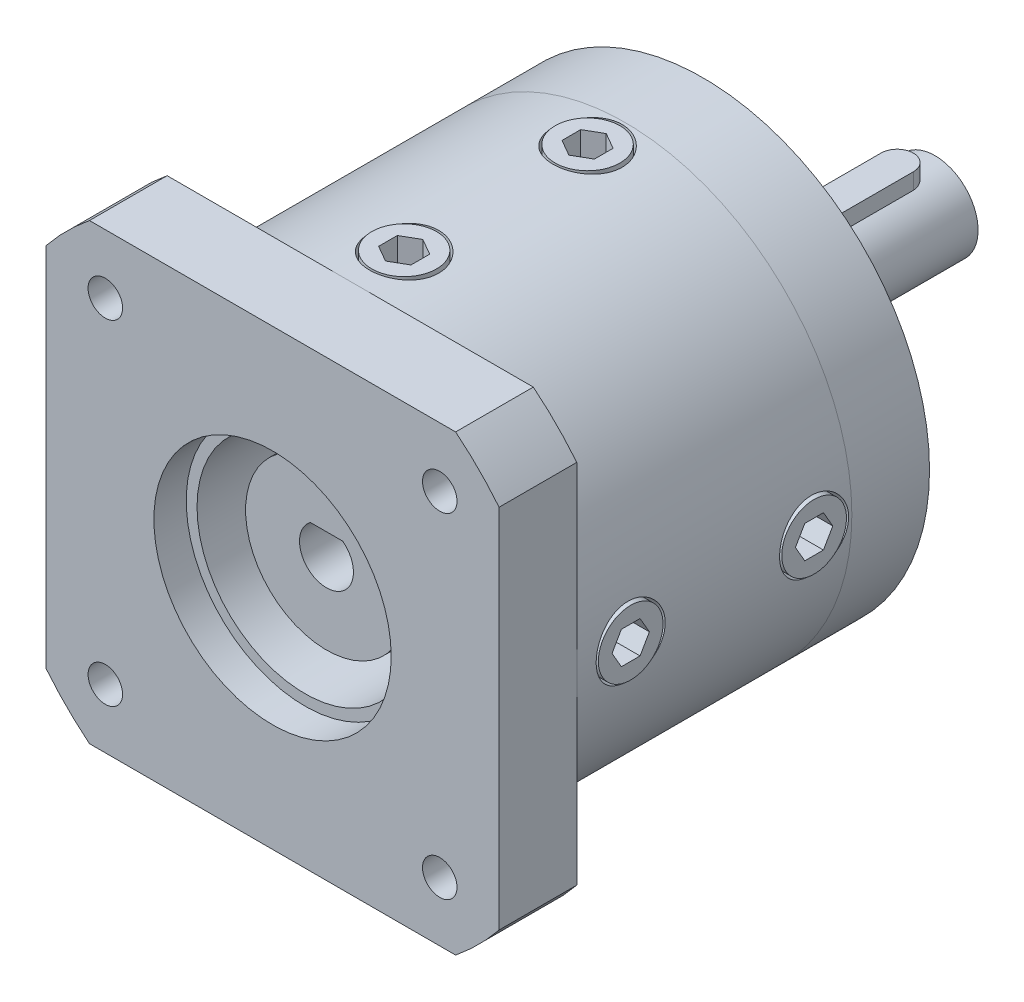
SolidWorks part; units mm, degrees
ref_plane "前视基准面" through (0, 0, 0) normal (0, 0, 1) x (1, 0, 0)
ref_plane "上视基准面" through (0, 0, 0) normal (0, 1, 0) x (1, 0, 0)
ref_plane "右视基准面" through (0, 0, 0) normal (1, 0, 0) x (0, 0, -1)
sketch "草图1" plane through (0, 0, 0) normal (0, 0, 1) x (1, 0, 0)
  line L1 (-16.9706, -21) -> (16.9706, -21)
  line L2 (-21, -16.9706) -> (-21, 16.9706)
  line L3 (-16.9706, 21) -> (16.9706, 21)
  line L4 (21, -16.9706) -> (21, 16.9706)
  line L5 (0, 21) -> (0, -21) construction
  line L6 (-21, 0) -> (21, 0) construction
  line L7 (-15.5, -15.5) -> (15.5, -15.5) construction
  line L8 (-15.5, -15.5) -> (-15.5, 15.5) construction
  line L9 (-15.5, 15.5) -> (15.5, 15.5) construction
  line L10 (15.5, -15.5) -> (15.5, 15.5) construction
  line L11 (0, 15.5) -> (0, -15.5) construction
  line L12 (-15.5, 0) -> (15.5, 0) construction
  arc A0 (-21, -16.9706) -> (-16.9706, -21) centre (0, 0) ccw
  arc A1 (16.9706, -21) -> (21, -16.9706) centre (0, 0) ccw
  arc A2 (21, 16.9706) -> (16.9706, 21) centre (0, 0) ccw
  arc A3 (-16.9706, 21) -> (-21, 16.9706) centre (0, 0) ccw
  circle A4 centre (-15.5, 15.5) radius 1.6
  circle A5 centre (15.5, 15.5) radius 1.6
  circle A6 centre (15.5, -15.5) radius 1.6
  circle A7 centre (-15.5, -15.5) radius 1.6
  point P0 (0, 0)
  point P22 (0, 0)
  dimension "D3" = 54
  dimension "D5" = 3.2
  dimension "D1" = 42
  dimension "D2" = 31
  dimension "D4" = 31
  dimension "D6" = 4
extrude "凸台-拉伸1" add sketch "草图1" along normal blind 7.2
sketch "草图2" plane through (0, 0, 0) normal (0, 0, -1) x (-1, 0, 0)
  circle A0 centre (0, 0) radius 21
  dimension "D1" = 42
extrude "凸台-拉伸2" add sketch "草图2" along normal blind 1.5
sketch "草图3" plane through (0, 0, -1.5) normal (0, 0, -1) x (-1, 0, 0)
  circle A0 centre (0, 0) radius 21
  dimension "D1" = 42
extrude "凸台-拉伸3" add sketch "草图3" along normal blind 24 separate body
sketch "草图4" plane through (0, 0, -25.5) normal (0, 0, -1) x (-1, 0, 0)
  circle A0 centre (0, 0) radius 21
  dimension "D1" = 42
extrude "凸台-拉伸4" add sketch "草图4" along normal blind 7.2 separate body
sketch "草图5" plane through (0, 0, -32.7) normal (0, 0, -1) x (-1, 0, 0)
  circle A0 centre (0, 0) radius 12.5
  circle A1 centre (0, 0) radius 11
  dimension "D1" = 25
  dimension "D2" = 22
extrude "凸台-拉伸5" add sketch "草图5" along normal blind 2
sketch "草图6" plane through (0, 0, 7.2) normal (0, 0, 1) x (1, 0, 0)
  circle A0 centre (0, 0) radius 11
  dimension "D1" = 22
extrude "切除-拉伸1" cut sketch "草图6" against normal blind 3
sketch "草图9" plane through (0, 0, -1.5) normal (0, 0, -1) x (-1, 0, 0)
  circle A0 centre (-15.5, 15.5) radius 3
  circle A1 centre (15.5, 15.5) radius 3
  circle A2 centre (15.5, -15.5) radius 3
  circle A3 centre (-15.5, -15.5) radius 3
  point P11 (0, 0)
  dimension "D1" = 6
  dimension "D2" = 4
extrude "切除-拉伸4" cut sketch "草图9" against normal blind 5
hole_wizard "M4 螺纹孔1" positions "草图11" profile "草图12" tap size "M4" standard "GB"
sketch "草图11" plane through (0, 0, -32.7) normal (0, 0, -1) x (-1, 0, 0)
  line L0 (-39.831, 0) -> (39.831, 0) construction
  line L2 (0, -29.9711) -> (0, 29.9711) construction
  circle A1 centre (0, 0) radius 17.5 construction
  point P0 (0, 17.5)
  point P2 (17.5, 0)
  point P4 (-17.5, 0)
  point P6 (0, -17.5)
  point P57 (0, 0)
  point P92 (0, 0)
  dimension "D1" = 35
sketch "草图12" plane through (0, 17.5, -32.7) normal (1, 0, 0) x (0, 1, 0)
  line L0 (0, 0) -> (0, 6.9914)
  line L1 (0, 6.9914) -> (1.65, 6)
  line L2 (1.65, 6) -> (1.65, 0)
  line L5 (1.65, 0) -> (0, 0)
  line L10 (0, 6.9914) -> (-1.65, 6) construction
  line L11 (0, -6.35) -> (0, 107.95) construction
  dimension "螺纹孔钻头直径" = 3.3
  dimension "螺纹孔钻头深度" = 6
  dimension "导头角度" = 118
sketch "草图13" plane through (-21, 0, 0) normal (-1, 0, 0) x (0, 0, 1)
  line L0 (0, 0) -> (-40.8495, 0) construction
  line L1 (-25.5, 0) -> (-22, 0) construction
  line L2 (-25.5, -21) -> (-25.5, 21) construction
  line L3 (-1.5, 0) -> (-5, 0) construction
  line L4 (-1.5, 12.7459) -> (-1.5, -12.7459) construction
  circle A0 centre (-22, 0) radius 3.2
  circle A1 centre (-5, 0) radius 3.2
  dimension "D3" = 6.4
  dimension "D4" = 6.4
  dimension "D1" = 3.5
  dimension "D2" = 3.5
extrude "切除-拉伸5" cut sketch "草图13" against normal blind 5
sketch "草图14" plane through (-16, 0, 0) normal (-1, 0, 0) x (0, 0, 1)
  line L1 (-20.2679, 0) -> (-21.134, 1.5)
  line L2 (-21.134, 1.5) -> (-22.866, 1.5)
  line L3 (-22.866, 1.5) -> (-23.7321, 0)
  line L4 (-23.7321, 0) -> (-22.866, -1.5)
  line L5 (-22.866, -1.5) -> (-21.134, -1.5)
  line L6 (-21.134, -1.5) -> (-20.2679, 0)
  line L7 (-3.2679, 0) -> (-4.134, 1.5)
  line L8 (-4.134, 1.5) -> (-5.866, 1.5)
  line L9 (-5.866, 1.5) -> (-6.7321, 0)
  line L10 (-6.7321, 0) -> (-5.866, -1.5)
  line L11 (-5.866, -1.5) -> (-4.134, -1.5)
  line L12 (-4.134, -1.5) -> (-3.2679, 0)
  circle A0 centre (-22, 0) radius 3
  circle A1 centre (-5, 0) radius 3
  circle A2 centre (-22, 0) radius 1.5 construction
  circle A3 centre (-5, 0) radius 1.5 construction
  dimension "D1" = 6
  dimension "D2" = 6
  dimension "D3" = 3
  dimension "D4" = 3
extrude "凸台-拉伸6" add sketch "草图14" along normal blind 5
sketch "草图15" plane through (0, 21, 0) normal (0, 1, 0) x (1, 0, 0)
  line L0 (0, 0) -> (0, 43.4375) construction
  line L1 (0, 25.5) -> (0, 22) construction
  line L2 (-21, 25.5) -> (21, 25.5) construction
  line L3 (0, 1.5) -> (0, 5) construction
  line L4 (-21, 1.5) -> (21, 1.5) construction
  circle A0 centre (0, 22) radius 3.2
  circle A1 centre (0, 5) radius 3.2
  dimension "D3" = 6.4
  dimension "D4" = 6.4
  dimension "D1" = 3.5
  dimension "D2" = 3.5
extrude "切除-拉伸7" cut sketch "草图15" against normal blind 5
sketch "草图16" plane through (0, 16, 0) normal (0, 1, 0) x (1, 0, 0)
  line L1 (0, 20.2679) -> (1.5, 21.134)
  line L2 (1.5, 21.134) -> (1.5, 22.866)
  line L3 (1.5, 22.866) -> (0, 23.7321)
  line L4 (0, 23.7321) -> (-1.5, 22.866)
  line L5 (-1.5, 22.866) -> (-1.5, 21.134)
  line L6 (-1.5, 21.134) -> (0, 20.2679)
  line L7 (0, 3.2679) -> (1.5, 4.134)
  line L8 (1.5, 4.134) -> (1.5, 5.866)
  line L9 (1.5, 5.866) -> (0, 6.7321)
  line L10 (0, 6.7321) -> (-1.5, 5.866)
  line L11 (-1.5, 5.866) -> (-1.5, 4.134)
  line L12 (-1.5, 4.134) -> (0, 3.2679)
  circle A0 centre (0, 22) radius 3
  circle A1 centre (0, 5) radius 3
  circle A2 centre (0, 22) radius 1.5 construction
  circle A3 centre (0, 5) radius 1.5 construction
  dimension "D1" = 6
  dimension "D2" = 6
  dimension "D3" = 3
  dimension "D4" = 3
extrude "凸台-拉伸7" add sketch "草图16" along normal blind 5
sketch "草图17" plane through (21, 0, 0) normal (1, 0, 0) x (0, 0, -1)
  line L0 (0, 0) -> (41.0655, 0) construction
  line L1 (1.5, 0) -> (5, 0) construction
  line L2 (1.5, -12.7459) -> (1.5, 12.7459) construction
  line L3 (25.5, 0) -> (22, 0) construction
  line L4 (25.5, -21) -> (25.5, 21) construction
  circle A0 centre (22, 0) radius 3.2
  circle A1 centre (5, 0) radius 3.2
  dimension "D3" = 6.4
  dimension "D4" = 6.4
  dimension "D1" = 3.5
  dimension "D2" = 3.5
extrude "切除-拉伸8" cut sketch "草图17" against normal blind 5
sketch "草图18" plane through (16, 0, 0) normal (1, 0, 0) x (0, 0, -1)
  line L1 (6.7321, 0) -> (5.866, 1.5)
  line L2 (5.866, 1.5) -> (4.134, 1.5)
  line L3 (4.134, 1.5) -> (3.2679, 0)
  line L4 (3.2679, 0) -> (4.134, -1.5)
  line L5 (4.134, -1.5) -> (5.866, -1.5)
  line L6 (5.866, -1.5) -> (6.7321, 0)
  line L7 (23.7321, 0) -> (22.866, 1.5)
  line L8 (22.866, 1.5) -> (21.134, 1.5)
  line L9 (21.134, 1.5) -> (20.2679, 0)
  line L10 (20.2679, 0) -> (21.134, -1.5)
  line L11 (21.134, -1.5) -> (22.866, -1.5)
  line L12 (22.866, -1.5) -> (23.7321, 0)
  circle A0 centre (5, 0) radius 3
  circle A1 centre (22, 0) radius 3
  circle A2 centre (5, 0) radius 1.5 construction
  circle A3 centre (22, 0) radius 1.5 construction
  dimension "D1" = 6
  dimension "D2" = 6
  dimension "D3" = 3
  dimension "D4" = 3
extrude "凸台-拉伸8" add sketch "草图18" along normal blind 5
sketch "草图19" plane through (0, -21, 0) normal (0, -1, 0) x (1, 0, 0)
  line L0 (0, 0) -> (0, -40.7996) construction
  line L1 (0, -1.5) -> (0, -5) construction
  line L2 (-12.7459, -1.5) -> (12.7459, -1.5) construction
  line L3 (0, -25.5) -> (0, -22) construction
  line L4 (21, -25.5) -> (-21, -25.5) construction
  circle A0 centre (0, -5) radius 3.2
  circle A1 centre (0, -22) radius 3.2
  dimension "D3" = 6.4
  dimension "D4" = 6.4
  dimension "D1" = 3.5
  dimension "D2" = 3.5
extrude "切除-拉伸9" cut sketch "草图19" against normal blind 5
sketch "草图20" plane through (0, -16, 0) normal (0, -1, 0) x (1, 0, 0)
  line L1 (0, -6.7321) -> (1.5, -5.866)
  line L2 (1.5, -5.866) -> (1.5, -4.134)
  line L3 (1.5, -4.134) -> (0, -3.2679)
  line L4 (0, -3.2679) -> (-1.5, -4.134)
  line L5 (-1.5, -4.134) -> (-1.5, -5.866)
  line L6 (-1.5, -5.866) -> (0, -6.7321)
  line L7 (0, -23.7321) -> (1.5, -22.866)
  line L8 (1.5, -22.866) -> (1.5, -21.134)
  line L9 (1.5, -21.134) -> (0, -20.2679)
  line L10 (0, -20.2679) -> (-1.5, -21.134)
  line L11 (-1.5, -21.134) -> (-1.5, -22.866)
  line L12 (-1.5, -22.866) -> (0, -23.7321)
  circle A0 centre (0, -5) radius 3
  circle A1 centre (0, -22) radius 3
  circle A2 centre (0, -5) radius 1.5 construction
  circle A3 centre (0, -22) radius 1.5 construction
  dimension "D1" = 6
  dimension "D2" = 6
  dimension "D3" = 3
  dimension "D4" = 3
extrude "凸台-拉伸9" add sketch "草图20" along normal blind 5
sketch "草图21" plane through (0, 0, -34.7) normal (0, 0, -1) x (-1, 0, 0)
  circle A0 centre (0, 0) radius 4
  dimension "D1" = 8
extrude "凸台-拉伸10" add sketch "草图21" along normal blind 21.5 from surface at -2
hole_wizard "M3 螺纹孔1" positions "草图22" profile "草图23" tap size "M3" standard "GB"
sketch "草图22" plane through (0, 0, -54.2) normal (0, 0, -1) x (-1, 0, 0)
  point P0 (0, 0)
sketch "草图23" plane through (0, 0, -54.2) normal (1, 0, 0) x (0, 1, 0)
  line L0 (0, 0) -> (0, 12.2511)
  line L1 (0, 12.2511) -> (1.25, 11.5)
  line L2 (1.25, 11.5) -> (1.25, 0)
  line L5 (1.25, 0) -> (0, 0)
  line L10 (0, 12.2511) -> (-1.25, 11.5) construction
  line L11 (0, -6.35) -> (0, 107.95) construction
  dimension "螺纹孔钻头直径" = 2.5
  dimension "螺纹孔钻头深度" = 11.5
  dimension "导头角度" = 118
sketch "草图26" plane through (0, 0, -32.7) normal (0, 0, -1) x (-1, 0, 0)
  line L0 (-0.3, 9.285) -> (-2.9588, 8.8162)
  line L8 (0.3, 5.785) -> (0.3, 9.285)
  line L9 (-0.3, 5.785) -> (-0.3, 9.285)
  line L10 (-0.3, 5.785) -> (0.3, 5.785)
  line L11 (0.3, 9.285) -> (2.9588, 8.8162)
  line L12 (-2.9588, 8.8162) -> (-3.7218, 5.6731)
  line L13 (2.9588, 8.8162) -> (3.7218, 5.6731)
  circle A1 centre (-1.629, 7.5869) radius 0.5
  circle A4 centre (1.629, 7.5869) radius 0.5
  arc A5 (-3.7218, 5.6731) -> (3.7218, 5.6731) centre (0, 0) ccw
  dimension "D2" = 3.5
  dimension "D7" = 1
  dimension "D8" = 13.57
  dimension "D5" = 3.5
extrude "凸台-拉伸12" add sketch "草图26" along normal blind 1
sketch "草图27" plane through (0, 0, 0) normal (0, 1, 0) x (1, 0, 0)
  line L0 (0, 39.7) -> (0, 50.7) construction
  line L1 (-1.5, 39.7) -> (-1.5, 50.7)
  line L2 (1.5, 39.7) -> (1.5, 50.7)
  line L3 (4, 54.2) -> (-4, 54.2) construction
  arc A0 (-1.5, 39.7) -> (1.5, 39.7) centre (0, 39.7) ccw
  arc A1 (1.5, 50.7) -> (-1.5, 50.7) centre (0, 50.7) ccw
  point P2 (0, 45.2)
  dimension "D3" = 3.5
  dimension "D1" = 3
  dimension "D2" = 11
extrude "凸台-拉伸13" add sketch "草图27" along normal blind 3 from offset 2.2
sketch "草图28" plane through (0, 0, 4.2) normal (0, 0, 1) x (1, 0, 0)
  circle A0 centre (0, 0) radius 10
  dimension "D1" = 20
extrude "切除-拉伸10" cut sketch "草图28" against normal blind 13
sketch "草图30" plane through (0, 0, -8.8) normal (0, 0, 1) x (1, 0, 0)
  circle A0 centre (0, 0) radius 7.5
  dimension "D1" = 15
extrude "凸台-拉伸14" add sketch "草图30" along normal blind 11
sketch "草图31" plane through (0, 0, 2.2) normal (0, 0, 1) x (1, 0, 0)
  line L1 (-1.5, 2) -> (1.5, 2)
  arc A0 (-1.5, 2) -> (1.5, 2) centre (0, 0) ccw
  point P8 (0, 2)
  dimension "D1" = 5
extrude "切除-拉伸11" cut sketch "草图31" against normal blind 7
hole_wizard "M3 螺纹孔2" positions "草图32" profile "草图33" tap size "M3" standard "GB"
sketch "草图32" plane through (0, 2, 0) normal (0, -1, 0) x (-1, 0, 0)
  point P0 (0, 0)
sketch "草图33" plane through (0, 2, 0) normal (1, 0, 0) x (0, 0, -1)
  line L0 (0, 0) -> (0, 5.501)
  line L1 (0, 5.501) -> (1.25, 5.501)
  line L2 (1.25, 5.501) -> (1.25, 0)
  line L5 (1.25, 0) -> (0, 0)
  line L11 (0, -6.35) -> (0, 107.95) construction
  dimension "通孔螺纹孔钻头直径" = 2.5
  dimension "通孔螺纹孔钻头深度" = 5.501
